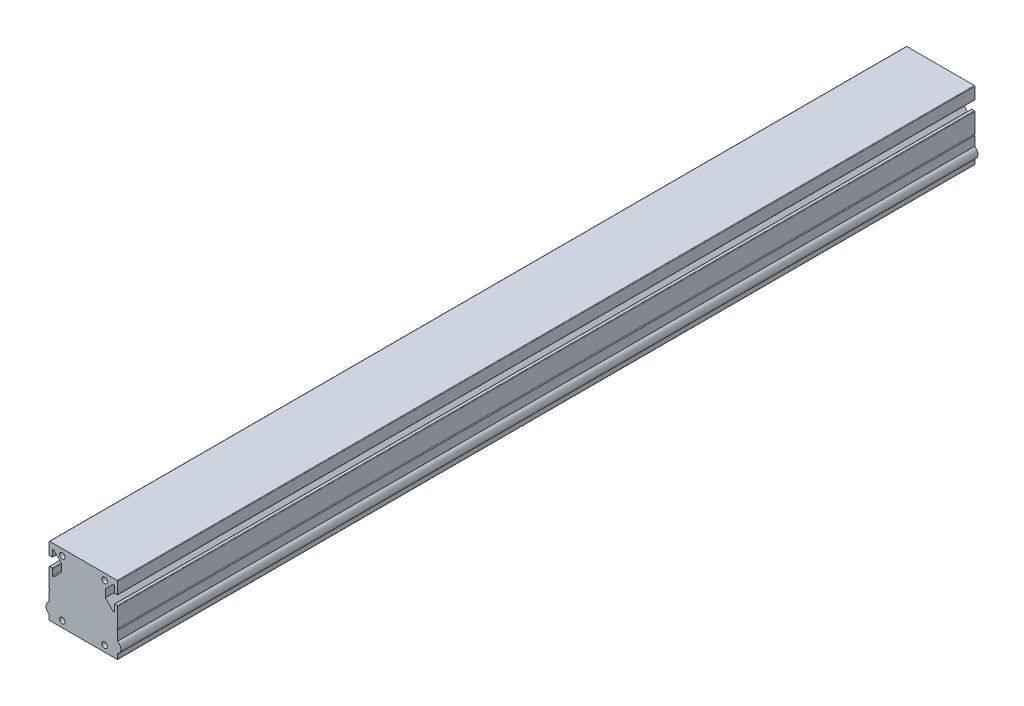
SolidWorks part; units mm, degrees
ref_plane "Ebene vorne" through (0, 0, 0) normal (0, 0, 1) x (1, 0, 0)
ref_plane "Ebene oben" through (0, 0, 0) normal (0, 1, 0) x (1, 0, 0)
ref_plane "Ebene rechts" through (0, 0, 0) normal (1, 0, 0) x (0, 0, -1)
sketch "Aussen" plane through (0, 0, 0) normal (0, 0, 1) x (1, 0, 0)
  line L4 (30, -30) -> (30, 30)
  line L5 (-30, 30) -> (-30, -30)
  line L6 (30, 30) -> (-30, 30)
  line L7 (30, -30) -> (-30, -30)
  point P3 (0, 30)
  point P4 (-30, 0)
  dimension "D1" = 60
  dimension "D2" = 60
extrude "Linear austragen1" add sketch "Aussen" along normal blind 750
sketch "Markierung" plane through (0, 0, 0) normal (0, 0, 1) x (1, 0, 0)
  line L0 (30, -30) -> (30, 30) construction
  line L1 (30, -7.6) -> (30, -6.4)
  line L2 (-30, -30) -> (30, -30) construction
  arc A1 (30, -6.4) -> (30, -7.6) centre (30, -7) ccw
  dimension "D1" = 0.6
  dimension "D2" = 23
extrude "Schnitt-Linear austragen2" cut sketch "Markierung" along normal through all
sketch "Führung" plane through (0, 0, 0) normal (0, 0, 1) x (1, 0, 0)
  line L0 (30, -30) -> (30, -7.6) construction
  line L1 (-30, -30) -> (30, -30) construction
  line L2 (30, -25.1958) -> (30, -16.2042)
  arc A1 (30, -16.2042) -> (30, -25.1958) centre (27.7, -20.7) ccw
  dimension "D1" = 5.05
  dimension "D2" = 2.3
  dimension "D3" = 9.3
extrude "Schnitt-Linear austragen3" cut sketch "Führung" along normal through all
sketch "NUT" plane through (0, 0, 0) normal (0, 0, 1) x (1, 0, 0)
  line L0 (30, -6.4) -> (30, 30) construction
  line L1 (30, 10.95) -> (30, 19.05)
  line L7 (30, 10.95) -> (27, 10.95)
  line L8 (27, 10.95) -> (27, 3.7929)
  line L9 (27, 3.7929) -> (19.2, 11.5929)
  line L10 (19.2, 11.5929) -> (19.2, 18.4071)
  line L11 (19.2, 18.4071) -> (27, 26.2071)
  line L12 (27, 26.2071) -> (27, 19.05)
  line L13 (27, 19.05) -> (30, 19.05)
  dimension "D1" = 19.2
  dimension "D2" = 7.8
  dimension "D3" = 26.2071
  dimension "D4" = 3.7929
  dimension "D5" = 7.1571
extrude "Schnitt-Linear austragen4" cut sketch "NUT" along normal through all
mirror "Spiegeln2" about plane through (0, 0, 0) normal (1, 0, 0) of "Schnitt-Linear austragen4", "Schnitt-Linear austragen3", "Schnitt-Linear austragen2"
fillet "Verrundung1" radius 0.5 16 edges at (30, 19.05, 375) (30, 10.95, 375) (27, 3.7929, 375) (27, 10.95, 375) (27, 26.2071, 375) (27, 19.05, 375) (30, -30, 375) (30, 30, 375) (-30, -30, 375) (-27, 3.7929, 375) (-27, 10.95, 375) (-30, 10.95, 375) (-30, 30, 375) (-30, 19.05, 375) (-27, 19.05, 375) (-27, 26.2071, 375)
fillet "Verrundung2" radius 0.3 4 edges at (30, -16.2042, 375) (30, -25.1958, 375) (-30, -25.1958, 375) (-30, -16.2042, 375)
hole_wizard "Ø4.9 (4.9) Durchmesser Bohrung1" positions "Skizze7" profile "Skizze8" hole size "Ø4.9" standard "DIN"
sketch "Skizze7" plane through (0, 0, 0) normal (0, 0, -1) x (-1, 0, 0)
  line L1 (-29.5, 30) -> (29.5, 30) construction
  line L2 (30, 29.5) -> (30, 19.55) construction
  line L3 (-30, 19.55) -> (-30, 29.5) construction
  line L4 (-30, -29.5) -> (-30, -25.6621) construction
  point P0 (-18.5, 24.5)
  point P5 (18.5, 24.5)
  point P8 (-18.5, -24.5)
  point P11 (18.5, -24.5)
  dimension "D1" = 37
  dimension "D2" = 49
  dimension "D3" = 37
  dimension "D4" = 49
  dimension "D5" = 5.5
  dimension "D6" = 11.5
  dimension "D7" = 11.5
  dimension "D8" = 11.5
sketch "Skizze8" plane through (18.5, 24.5, 0) normal (1, 0, 0) x (0, 1, 0)
  line L0 (0, 0) -> (0, 750)
  line L1 (0, 750) -> (2.45, 750)
  line L2 (2.45, 750) -> (2.45, 0)
  line L5 (2.45, 0) -> (0, 0)
  line L11 (0, -6.35) -> (0, 107.95) construction
  dimension "Bohrerdurchmesser" = 4.9
  dimension "Bohrungstiefe" = 750
sketch "Skizze9" plane through (0, 0, 750) normal (0, 0, 1) x (1, 0, 0)
  circle A0 centre (-27.7, -20.7) radius 5.05
  circle A1 centre (27.7, -20.7) radius 5.05
  dimension "D1" = 10.1
  dimension "D2" = 10.1
extrude "Linear austragen2" add sketch "Skizze9" against normal up to surface (750 mm away)
